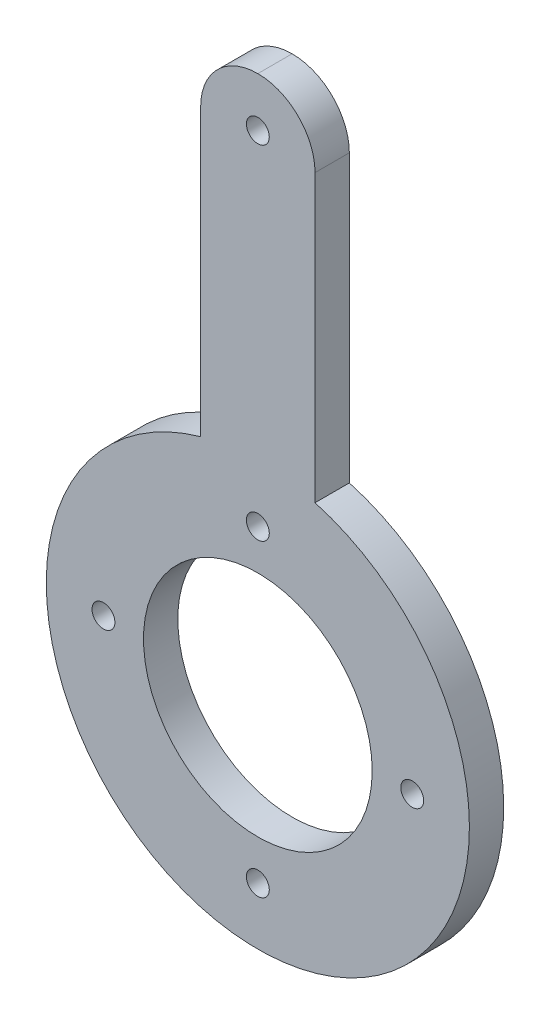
SolidWorks part; units mm, degrees
ref_plane "Alzado" through (0, 0, 0) normal (0, 0, 1) x (1, 0, 0)
ref_plane "Planta" through (0, 0, 0) normal (0, 1, 0) x (1, 0, 0)
ref_plane "Vista lateral" through (0, 0, 0) normal (1, 0, 0) x (0, 0, -1)
sketch "Croquis1" plane through (0, 0, 0) normal (0, 0, 1) x (1, 0, 0)
  line L1 (-5, 47.8115) -> (5, 47.8115)
  line L2 (-5, 47.8115) -> (-5, 17.8115)
  line L4 (5, 47.8115) -> (5, 17.8115)
  arc A0 (-5, 17.8115) -> (5, 17.8115) centre (0, 0) ccw
  circle A1 centre (0, 0) radius 10
  circle A2 centre (0, 0) radius 13.5 construction
  circle A3 centre (0, 13.5) radius 1
  circle A4 centre (13.5, 0) radius 1
  circle A5 centre (0, -13.5) radius 1
  circle A6 centre (-13.5, 0) radius 1
  circle A7 centre (0, 43.5) radius 1
  point P1 (0, 47.8115)
  point P16 (0, 0)
  point P18 (0, 0)
  dimension "D1" = 37
  dimension "D2" = 20
  dimension "D3" = 27
  dimension "D4" = 2
  dimension "D8" = 30
  dimension "D9" = 2
  dimension "D6" = 10
  dimension "D7" = 30
  dimension "D5" = 4
extrude "Saliente-Extruir1" add sketch "Croquis1" along normal blind 3
fillet "Redondeo1" radius 5 2 edges at (5, 47.8115, 1.5) (-5, 47.8115, 1.5)
